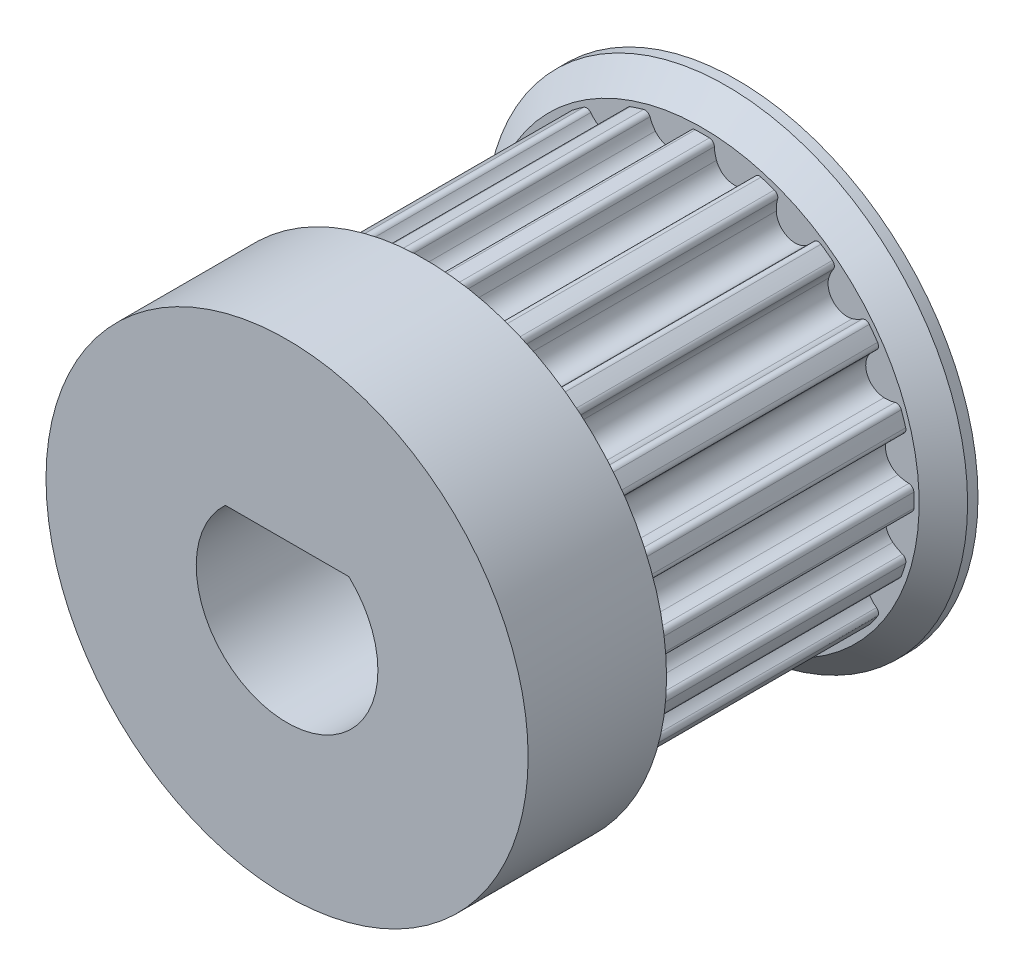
SolidWorks part; units mm, degrees
ref_plane "Front Plane" through (0, 0, 0) normal (0, 0, 1) x (1, 0, 0)
ref_plane "Top Plane" through (0, 0, 0) normal (0, 1, 0) x (1, 0, 0)
ref_plane "Right Plane" through (0, 0, 0) normal (1, 0, 0) x (0, 0, -1)
sketch "Sketch1" plane through (0, 0, 0) normal (0, 0, 1) x (1, 0, 0)
  circle A0 centre (0, 0) radius 6.3662
extrude "Boss-Extrude1" add sketch "Sketch1" along normal mid plane 8
sketch "Sketch3" plane through (0, 0, 4) normal (0, 0, 1) x (1, 0, 0)
  line L0 (0, 0) -> (0, 6.3662) construction
  line L1 (0, 0) -> (0.8395, 5.3001) construction
  line L2 (0, 6.3662) -> (0, 6.1162)
  line L3 (1.3888, 6.2129) -> (1.3479, 5.9985) construction
  line L4 (0.9959, 6.2878) -> (1.3888, 6.2129)
  line L5 (0.8395, 5.3001) -> (0.9959, 6.2878) construction
  line L6 (1.9673, 6.0546) -> (1.89, 5.8168)
  circle A0 centre (0, 0) radius 6.3662 construction
  arc A1 (0, 6.1162) -> (0.2035, 6.1128) centre (0, 0) cw
  circle A2 centre (0, 0) radius 6.3662
  circle A3 centre (0, 0) radius 6.3662
  arc A4 (0.2035, 6.1128) -> (0.3484, 5.9675) centre (0.1985, 5.9629) cw
  arc A5 (0.3484, 5.9675) -> (0.4092, 5.6538) centre (1.3479, 5.9985) ccw
  arc A6 (0.4092, 5.6538) -> (1.3579, 5.5035) centre (0.9255, 5.8434) ccw
  arc A7 (1.89, 5.8168) -> (1.6955, 5.8765) centre (0, 0) ccw
  arc A8 (1.6955, 5.8765) -> (1.5127, 5.7831) centre (1.6539, 5.7324) ccw
  arc A9 (1.5127, 5.7831) -> (1.3579, 5.5035) centre (0.5717, 6.1214) cw
extrude "Cut-Extrude1" cut sketch "Sketch3" against normal up to surface (8 mm away) contours A9 A8 A7 L6 L5 L4 L2 A1 A4 A5 A6 | L5 L4
pattern_circular "CirPattern1" count 20 over 360 about axis through (0, 0, 0) along (0, 0, 1) of "Cut-Extrude1"
sketch "Sketch4" plane through (0, 0, 4) normal (0, 0, 1) x (1, 0, 0)
  circle A0 centre (0, 0) radius 6.9662
extrude "Boss-Extrude2" add sketch "Sketch4" along normal blind 1
mirror "Mirror1" about plane through (0, 0, 0) normal (0, 0, 1) of "Boss-Extrude2"
chamfer "Chamfer1" distance 0.7 angle 45 1 edges at (6.9662, 0, -4)
sketch "Sketch5" plane through (0, 0, 5) normal (0, 0, 1) x (1, 0, 0)
  line L0 (-1.7847, 1.925) -> (1.7847, 1.925)
  circle A0 centre (0, 0) radius 2.625
  dimension "D1" = 5.25
  dimension "D2" = 4.55
extrude "Cut-Extrude2" cut sketch "Sketch5" against normal through all contours L0 A0
sketch "Sketch6" plane through (0, 0, 5) normal (0, 0, 1) x (1, 0, 0)
  line L0 (-1.7847, 1.925) -> (1.7847, 1.925) construction
  line L1 (-1.7847, 1.925) -> (1.7847, 1.925)
  arc A0 (-1.7847, 1.925) -> (1.7847, 1.925) centre (0, 0) ccw construction
  circle A1 centre (0, 0) radius 6.9662
  circle A2 centre (0, 0) radius 6.9662
  arc A3 (-1.7847, 1.925) -> (1.7847, 1.925) centre (0, 0) ccw
  dimension "D1" = 0
extrude "Boss-Extrude3" add sketch "Sketch6" along normal blind 3
sketch "Sketch8" plane through (0, 0, -5) normal (0, 0, -1) x (-1, 0, 0)
  circle A0 centre (0, 0) radius 2.625
  arc A1 (-1.7847, 1.925) -> (1.7847, 1.925) centre (0, 0) ccw construction
extrude "Cut-Extrude3" cut sketch "Sketch8" against normal blind 3
equation "\"n\" = 20'teeth number"
equation "\"p\"= 2mm'tooth spacing"
equation "\"pd\"= \"n\" * \"p\" / pi"
equation "\"D1@Sketch1\"=\"pd\""
equation "\"halfToothAngle\"= 180 / \"n\""
equation "\"D1@Sketch3\"=\"halfToothAngle\""
equation "\"D1@CirPattern1\"=\"n\""
equation "\"flangeDia\"= \"pd\" + 1.2"
equation "\"D1@Sketch4\"=\"flangeDia\""
